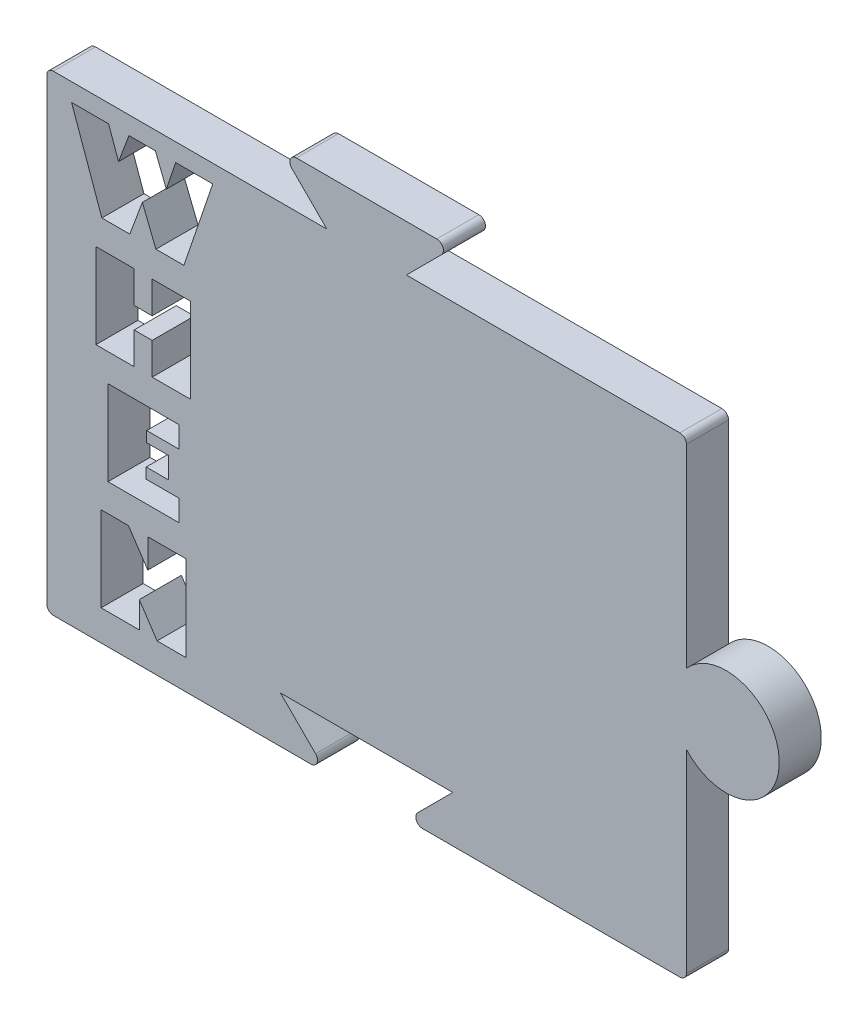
SolidWorks part; units mm, degrees
ref_plane "Front" through (0, 0, 0) normal (0, 0, 1) x (1, 0, 0)
ref_plane "Top" through (0, 0, 0) normal (0, 1, 0) x (1, 0, 0)
ref_plane "Right" through (0, 0, 0) normal (1, 0, 0) x (0, 0, -1)
sketch "Sketch1" plane through (0, 0, 0) normal (0, 0, 1) x (1, 0, 0)
  line L0 (0, 0) -> (0, 35.56) construction
  line L1 (48.26, 35.56) -> (48.26, 20.4258)
  line L2 (48.26, 0) -> (0, 0) construction
  line L3 (0, 35.56) -> (48.26, 35.56) construction
  line L4 (0, 17.78) -> (48.26, 17.78) construction
  line L5 (24.13, 35.56) -> (24.13, 0) construction
  line L6 (0, 35.56) -> (21.13, 35.56)
  line L7 (17.63, 39.06) -> (21.13, 35.56)
  line L8 (17.63, 39.06) -> (30.63, 39.06)
  line L9 (27.13, 35.56) -> (30.63, 39.06)
  line L10 (48.26, 35.56) -> (27.13, 35.56)
  line L11 (0, 0) -> (21.13, 0)
  line L12 (17.63, 3.5) -> (21.13, 0)
  line L13 (27.13, 0) -> (30.63, 3.5)
  line L14 (30.63, 3.5) -> (17.63, 3.5)
  line L15 (48.26, 0) -> (27.13, 0)
  line L16 (0, 35.56) -> (0, 0)
  line L21 (48.26, 15.1342) -> (48.26, 0)
  arc A0 (48.26, 15.1342) -> (48.26, 20.4258) centre (51.26, 17.78) ccw
  point P13 (24.13, 39.06)
  point P16 (24.13, 3.5)
  point P25 (51.26, 17.78)
  dimension "D13" = 8
  dimension "D1" = 35.56
  dimension "D2" = 3
  dimension "D3" = 48.26
  dimension "D4" = 3.5
  dimension "D5" = 45
  dimension "D6" = 3
  dimension "D7" = 3.5
  dimension "D8" = 45
  dimension "D12" = 3
extrude "Boss-Extrude1" add sketch "Sketch1" along normal blind 3.175
sketch "Sketch4" plane through (0, 0, 3.175) normal (0, 0, 1) x (1, 0, 0)
  line L0 (7.2314, 39.1047) -> (7.2314, -1.5474) construction
  text T0 "W" font "Gill Sans Ultra Bold" height in points 24
  text T1 "H" font "Gill Sans Ultra Bold" height in points 24
  text T2 "E" font "Gill Sans Ultra Bold" height in points 24
  text T3 "N" font "Gill Sans Ultra Bold" height in points 24
  dimension "D1" = 8.5
  dimension "D2" = 8.5
  dimension "D3" = 8.5
extrude "Cut-Extrude3" cut sketch "Sketch4" against normal through all
sketch "Sketch5" plane through (0, 0, 3.175) normal (0, 0, 1) x (1, 0, 0)
  line L0 (0, 17.78) -> (57.362, 17.78) construction
  line L1 (18.7227, 5.08) -> (44.1227, 5.08)
  line L2 (18.7227, 5.08) -> (18.7227, 30.48)
  line L3 (18.7227, 30.48) -> (44.1227, 30.48)
  line L4 (44.1227, 5.08) -> (44.1227, 30.48)
  line L5 (0, 35.56) -> (0, 0) construction
  point P8 (18.7227, 17.78)
  dimension "D1" = 25.4
extrude "Cut-Extrude4" [suppressed] cut sketch "Sketch5" against normal blind 2
fillet "Fillet1" radius 0.5 8 edges at (48.26, 35.56, 1.5875) (48.26, 0, 1.5875) (0, 35.56, 1.5875) (30.63, 39.06, 1.5875) (17.63, 39.06, 1.5875) (27.13, 0, 1.5875) (21.13, 0, 1.5875) (0, 0, 1.5875)
